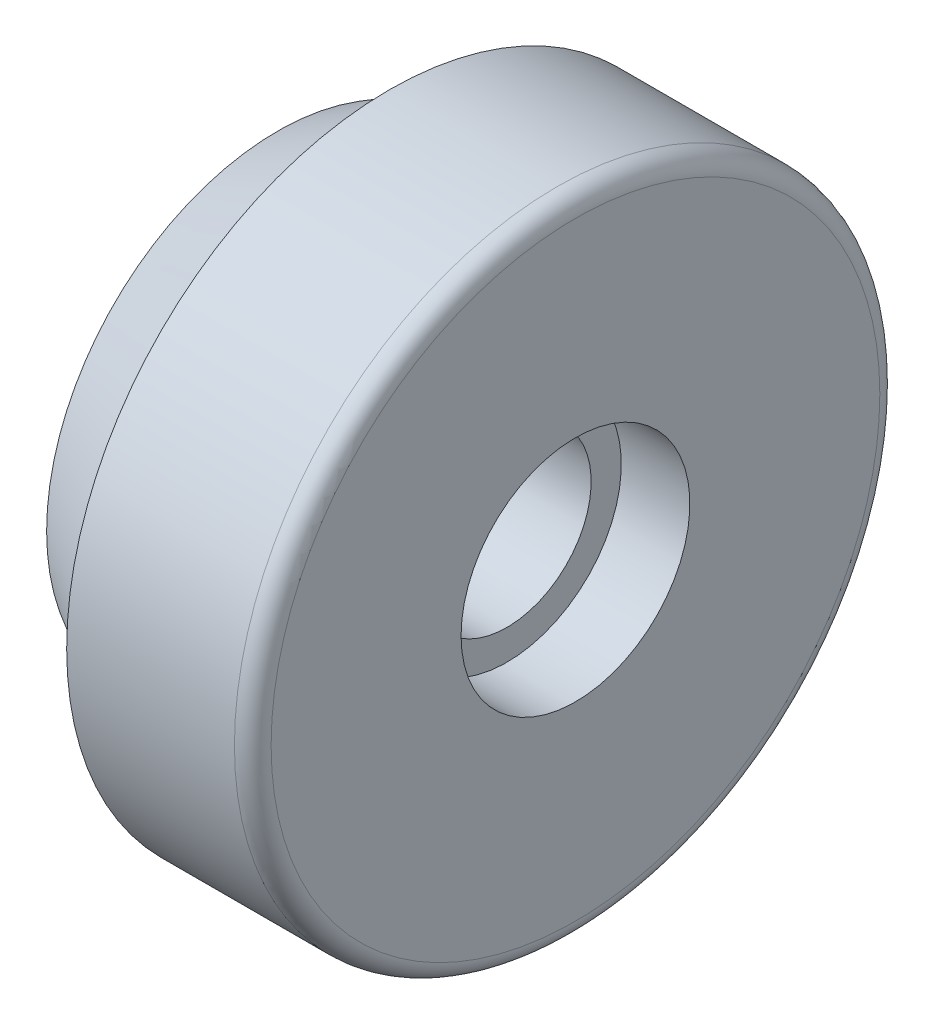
SolidWorks part; units mm, degrees
ref_plane "Front Plane" through (0, 0, 0) normal (0, 0, 1) x (1, 0, 0)
ref_plane "Top Plane" through (0, 0, 0) normal (0, 1, 0) x (1, 0, 0)
ref_plane "Right Plane" through (0, 0, 0) normal (1, 0, 0) x (0, 0, -1)
sketch "Sketch1" plane through (0, 0, 0) normal (0, 0, 1) x (1, 0, 0)
  line L0 (-17.4625, 55.88) -> (-46.5137, 55.88) construction
  line L1 (-17.4625, 55.88) -> (-46.5137, 55.88)
  line L2 (-14.2875, 52.705) -> (-14.2875, -52.705) construction
  line L3 (-46.5137, 56.3499) -> (-46.5137, -56.3499) construction
  line L4 (-47.1487, 50.8) -> (-65.8812, 39.9848) construction
  line L5 (-14.2875, 52.705) -> (-14.2875, 19.812)
  line L6 (-46.5137, 55.88) -> (-46.5137, 51.1666)
  line L7 (-46.5137, 51.1666) -> (-65.8812, 39.9848)
  line L8 (-65.8813, 56.75) -> (-65.8813, 0.0379) construction
  line L9 (-65.8812, 39.9848) -> (-65.8813, 0)
  line L10 (-49.4355, 0) -> (-65.8813, 0)
  line L11 (0, 0) -> (25.9401, 0) construction
  line L12 (-13.462, 19.812) -> (-26.162, 19.812) construction
  line L13 (-14.2875, 19.812) -> (-26.162, 19.812)
  line L14 (-26.162, 19.812) -> (-26.162, -19.812) construction
  line L15 (-26.162, 14.5927) -> (-49.4355, 14.5927) construction
  line L16 (-49.4355, 14.5927) -> (-49.4355, -14.5927) construction
  line L17 (-26.162, 19.812) -> (-26.162, 14.5927)
  line L18 (-26.162, 14.5927) -> (-49.4355, 14.5927)
  line L19 (-49.4355, 14.5927) -> (-49.4355, 0)
  arc A0 (-14.2875, 52.705) -> (-17.4625, 55.88) centre (-17.4625, 52.705) ccw construction
  arc A1 (-14.2875, 52.705) -> (-17.4625, 55.88) centre (-17.4625, 52.705) ccw
revolve "Revolve1" add sketch "Sketch1" angle 360 about L11
